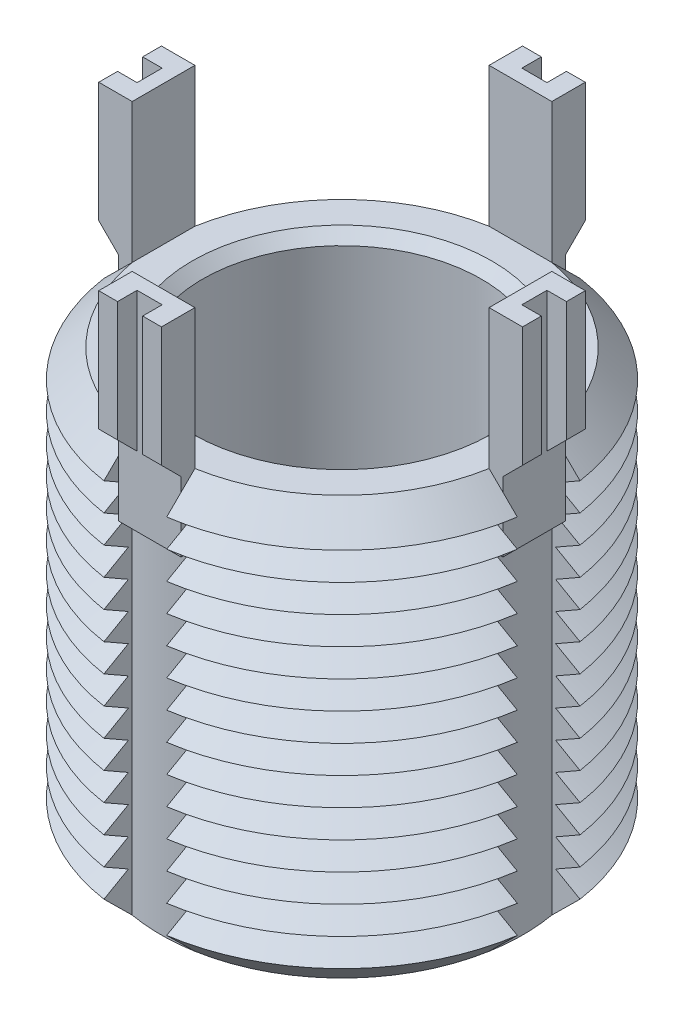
SolidWorks part; units mm, degrees
ref_plane "Front Plane" through (0, 0, 0) normal (0, 0, 1) x (1, 0, 0)
ref_plane "Top Plane" through (0, 0, 0) normal (0, 1, 0) x (1, 0, 0)
ref_plane "Right Plane" through (0, 0, 0) normal (1, 0, 0) x (0, 0, -1)
sketch "Sketch1" plane through (0, 0, 0) normal (0, 1, 0) x (1, 0, 0)
  circle A0 centre (0, 0) radius 15
  dimension "D1" = 30
extrude "Boss-Extrude1" add sketch "Sketch1" against normal blind 30
chamfer "Chamfer1" distance 2 angle 45 2 edges at (0, -30, 15) (0, 0, 15)
sketch "Sketch2" plane through (0, 0, 0) normal (1, 0, 0) x (0, 0, -1)
  line L0 (0, 0.8859) -> (0, -9.2617) construction
sketch "Sketch3" plane through (0, 0, 0) normal (1, 0, 0) x (0, 0, -1)
  line L0 (-15, -2) -> (-13.2679, -3)
  line L1 (-13.2679, -3) -> (-15, -4)
  line L2 (-15, -2) -> (-15, -28) construction
  line L3 (-15, -4) -> (-15, -2)
  dimension "D1" = 2
revolve "Cut-Revolve1" cut sketch "Sketch3" angle 360 about L0
pattern_linear "LPattern1" count 13 spacing 2 along (0, -1, 0) of "Cut-Revolve1"
sketch "Sketch4" plane through (0, 0, 0) normal (0, 1, 0) x (1, 0, 0)
  line L0 (-12.8038, 2.25) -> (-14.8303, 2.25)
  line L2 (-14.8303, -2.25) -> (-12.8038, -2.25)
  arc A0 (-12.8038, 2.25) -> (-12.8038, -2.25) centre (0, 0) ccw
  arc A1 (-14.8303, 2.25) -> (-14.8303, -2.25) centre (0, 0) ccw
  circle A2 centre (0, 0) radius 15 construction
  circle A3 centre (0, 0) radius 13 construction
  point P1 (-13, 0)
  point P3 (-15, 0)
  point P13 (0, 0)
  dimension "D1" = 4.5
extrude "Cut-Extrude1" cut sketch "Sketch4" against normal up to surface (30 mm away)
pattern_circular "CirPattern1" count 4 over 360 about axis through (0, 0, 0) along (0, 1, 0) of "Cut-Extrude1"
sketch "Sketch5" plane through (0, 0, 0) normal (1, 0, 0) x (0, 0, -1)
  line L0 (-12.8038, 10) -> (-12.8038, -5)
  line L1 (-12.8038, -5) -> (-13.8038, -5)
  line L2 (-13.8038, -5) -> (-13.8038, 0)
  line L3 (-13.8038, 0) -> (-15.2038, 1.4)
  line L4 (-15.2038, 1.4) -> (-15.2038, 10)
  line L5 (-15.2038, 10) -> (-12.8038, 10)
  line L6 (-14.8303, -6) -> (-2.25, -6) construction
  point P9 (-2.25, 0)
  point P10 (-13.8038, 0)
  dimension "D1" = 1
  dimension "D2" = 15
  dimension "D3" = 10
  dimension "D4" = 2.4
  dimension "D5" = 1
  dimension "D6" = 45
extrude "Boss-Extrude3" add sketch "Sketch5" along normal mid plane 4.5
pattern_circular "CirPattern2" count 4 over 360 about axis through (0, 0, 0) along (0, 1, 0) of "Boss-Extrude3"
sketch "Sketch6" plane through (0, 10, 0) normal (0, 1, 0) x (1, 0, 0)
  line L0 (-15.2038, -2.25) -> (-15.2038, 2.25) construction
  line L1 (-15.2038, -0.9) -> (-13.8038, -0.9)
  line L2 (-15.2038, -0.9) -> (-15.2038, 0.9)
  line L3 (-15.2038, 0.9) -> (-13.8038, 0.9)
  line L4 (-13.8038, -0.9) -> (-13.8038, 0.9)
  line L5 (-15.2038, -0.9) -> (-13.8038, 0.9) construction
  line L6 (-15.2038, 0.9) -> (-13.8038, -0.9) construction
  line L7 (15.2038, 2.25) -> (15.2038, -2.25) construction
  line L8 (-0.9, 13.8038) -> (0.9, 13.8038)
  line L9 (-0.9, 13.8038) -> (-0.9, 15.2038)
  line L10 (-0.9, 15.2038) -> (0.9, 15.2038)
  line L11 (0.9, 13.8038) -> (0.9, 15.2038)
  line L12 (-0.9, 13.8038) -> (0.9, 15.2038) construction
  line L13 (-0.9, 15.2038) -> (0.9, 13.8038) construction
  line L14 (13.8038, -0.9) -> (15.2038, -0.9)
  line L15 (13.8038, -0.9) -> (13.8038, 0.9)
  line L16 (13.8038, 0.9) -> (15.2038, 0.9)
  line L17 (15.2038, -0.9) -> (15.2038, 0.9)
  line L18 (13.8038, -0.9) -> (15.2038, 0.9) construction
  line L19 (13.8038, 0.9) -> (15.2038, -0.9) construction
  line L20 (-0.9, -15.2038) -> (0.9, -15.2038)
  line L21 (-0.9, -15.2038) -> (-0.9, -13.8038)
  line L22 (-0.9, -13.8038) -> (0.9, -13.8038)
  line L23 (0.9, -15.2038) -> (0.9, -13.8038)
  line L24 (-0.9, -15.2038) -> (0.9, -13.8038) construction
  line L25 (-0.9, -13.8038) -> (0.9, -15.2038) construction
  line L26 (-2.25, 15.2038) -> (2.25, 15.2038) construction
  line L27 (2.25, -15.2038) -> (-2.25, -15.2038) construction
  point P0 (-14.5038, 0)
  point P7 (-15.2038, 0)
  point P8 (-15.2038, 0)
  point P9 (0, 14.5038)
  point P14 (14.5038, 0)
  point P19 (0, -14.5038)
  point P24 (0, 15.2038)
  point P25 (15.2038, 0)
  point P26 (15.2038, 0)
  point P27 (0, 15.2038)
  point P30 (0, -15.2038)
  point P33 (0, -15.2038)
  dimension "D1" = 1.8
  dimension "D2" = 1.4
extrude "Cut-Extrude3" cut sketch "Sketch6" against normal through all both and the other way through all
sketch "Sketch7" plane through (0, 0, 0) normal (0, 1, 0) x (1, 0, 0)
  circle A0 centre (0, 0) radius 10
  dimension "D1" = 20
extrude "Cut-Extrude4" cut sketch "Sketch7" against normal up to surface (30 mm away)
chamfer "Chamfer2" distance 0.75 angle 45 2 edges at (0, 0, 10) (0, -30, 10)
